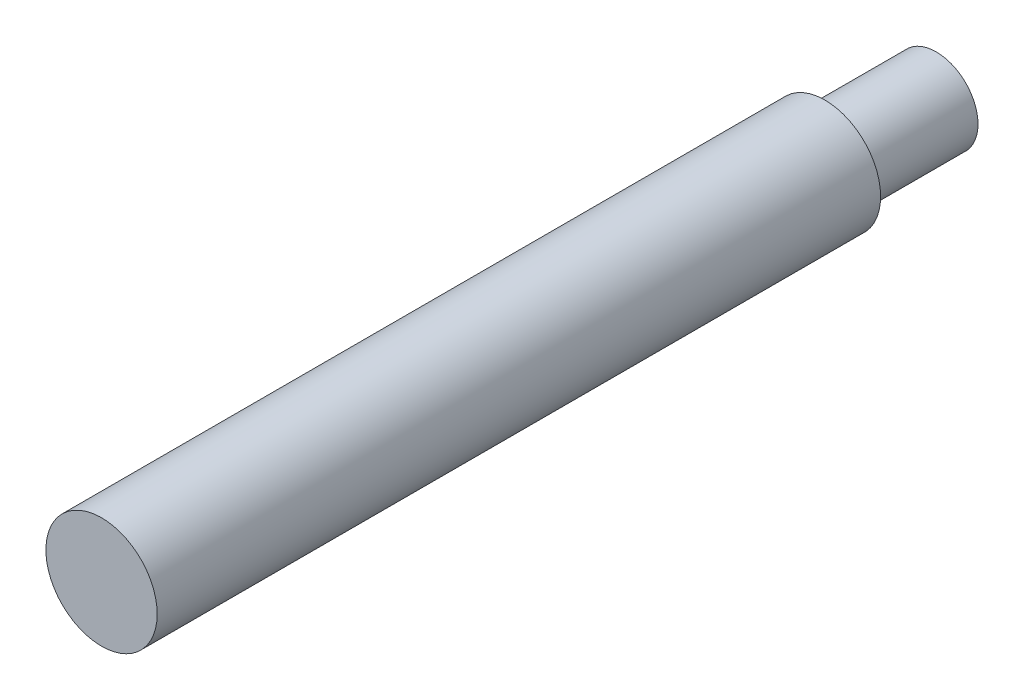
SolidWorks part; units mm, degrees
ref_plane "front" through (0, 0, 0) normal (0, 0, 1) x (1, 0, 0)
ref_plane "top" through (0, 0, 0) normal (0, 1, 0) x (1, 0, 0)
ref_plane "side" through (0, 0, 0) normal (1, 0, 0) x (0, 0, -1)
sketch "Sketch1" plane through (0, 0, 0) normal (0, 0, 1) x (1, 0, 0)
  circle A0 centre (0, 0) radius 12.7
  dimension "D1" = 25.4
extrude "Base-Extrude" add sketch "Sketch1" along normal blind 165.1
sketch "Sketch2" plane through (0, 0, 0) normal (0, 0, -1) x (-1, 0, 0)
  circle A0 centre (0, 0) radius 9.525
  dimension "D1" = 19.05
extrude "Boss-Extrude1" add sketch "Sketch2" along normal blind 25.4
